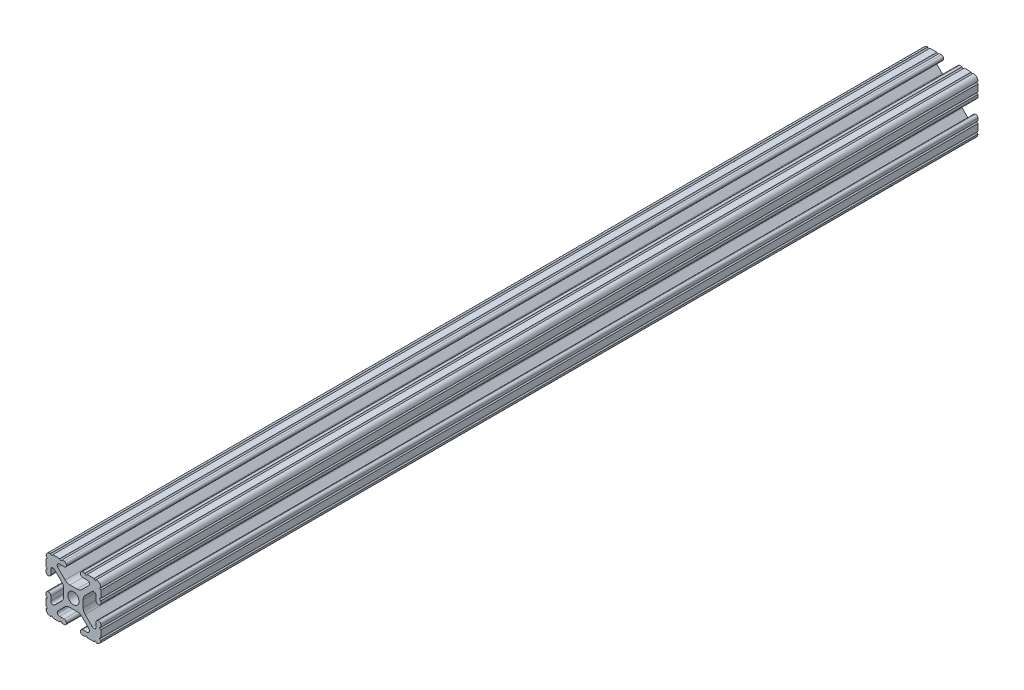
SolidWorks part; units mm, degrees
ref_plane "Front Plane" through (0, 0, 0) normal (0, 0, 1) x (1, 0, 0)
ref_plane "Top Plane" through (0, 0, 0) normal (0, 1, 0) x (1, 0, 0)
ref_plane "Right Plane" through (0, 0, 0) normal (1, 0, 0) x (0, 0, -1)
sketch "Sketch1" plane through (0, 0, 0) normal (0, 0, 1) x (1, 0, 0)
  line L88 (-7.1797, -8.6452) -> (-3.9523, -5.4237)
  line L89 (-1.7093, -4.4958) -> (1.7093, -4.4958)
  line L90 (3.9523, -5.4237) -> (7.1797, -8.6452)
  line L91 (6.4164, -10.4902) -> (4.2875, -10.4902)
  line L92 (3.2385, -11.5392) -> (3.2385, -11.651)
  line L93 (4.2875, -12.7) -> (5.3171, -12.7)
  line L94 (6.3331, -12.7) -> (9.5504, -12.7)
  line L95 (12.7, -9.5504) -> (12.7, -6.3331)
  line L96 (12.7, -5.3171) -> (12.7, -4.2875)
  line L97 (11.651, -3.2385) -> (11.5392, -3.2385)
  line L98 (10.4902, -4.2875) -> (10.4902, -6.4021)
  line L99 (8.7371, -7.1294) -> (5.441, -3.8408)
  line L100 (4.5085, -1.5932) -> (4.5085, 1.5932)
  line L101 (5.441, 3.8408) -> (8.7371, 7.1294)
  line L102 (10.4902, 6.4021) -> (10.4902, 4.2875)
  line L103 (11.5392, 3.2385) -> (11.651, 3.2385)
  line L104 (12.7, 4.2875) -> (12.7, 5.3171)
  line L105 (12.7, 6.3331) -> (12.7, 9.5504)
  line L106 (9.5504, 12.7) -> (6.3331, 12.7)
  line L107 (5.3171, 12.7) -> (4.2875, 12.7)
  line L108 (3.2385, 11.651) -> (3.2385, 11.5392)
  line L109 (4.2875, 10.4902) -> (6.4768, 10.4902)
  line L110 (7.207, 8.7244) -> (3.8983, 5.4232)
  line L111 (1.6558, 4.4958) -> (-1.6558, 4.4958)
  line L112 (-3.8983, 5.4232) -> (-7.207, 8.7244)
  line L113 (-6.4768, 10.4902) -> (-4.2875, 10.4902)
  line L114 (-3.2385, 11.5392) -> (-3.2385, 11.651)
  line L115 (-4.2875, 12.7) -> (-5.3171, 12.7)
  line L116 (-6.3331, 12.7) -> (-9.5504, 12.7)
  line L117 (-12.7, 9.5504) -> (-12.7, 6.3331)
  line L118 (-12.7, 5.3171) -> (-12.7, 4.2875)
  line L119 (-11.651, 3.2385) -> (-11.5392, 3.2385)
  line L120 (-10.4902, 4.2875) -> (-10.4902, 6.4021)
  line L121 (-8.7371, 7.1294) -> (-5.441, 3.8408)
  line L122 (-4.5085, 1.5932) -> (-4.5085, -1.5932)
  line L123 (-5.441, -3.8408) -> (-8.7371, -7.1294)
  line L124 (-10.4902, -6.4021) -> (-10.4902, -4.2875)
  line L125 (-11.5392, -3.2385) -> (-11.651, -3.2385)
  line L126 (-12.7, -4.2875) -> (-12.7, -5.3171)
  line L127 (-12.7, -6.3331) -> (-12.7, -9.5504)
  line L128 (-9.5504, -12.7) -> (-6.3331, -12.7)
  line L129 (-5.3171, -12.7) -> (-4.2875, -12.7)
  line L130 (-3.2385, -11.651) -> (-3.2385, -11.5392)
  line L131 (-4.2875, -10.4902) -> (-6.4164, -10.4902)
  circle A1 centre (0, 0) radius 2.6035
  arc A104 (-7.1797, -8.6452) -> (-6.4164, -10.4902) centre (-6.4164, -9.4098) ccw
  arc A105 (-1.7093, -4.4958) -> (-3.9523, -5.4237) centre (-1.7093, -7.6708) ccw
  arc A106 (3.9523, -5.4237) -> (1.7093, -4.4958) centre (1.7093, -7.6708) ccw
  arc A107 (6.4164, -10.4902) -> (7.1797, -8.6452) centre (6.4164, -9.4098) ccw
  arc A108 (4.2875, -10.4902) -> (3.2385, -11.5392) centre (4.2875, -11.5392) ccw
  arc A109 (3.2385, -11.651) -> (4.2875, -12.7) centre (4.2875, -11.651) ccw
  arc A110 (6.3331, -12.7) -> (5.3171, -12.7) centre (5.8251, -12.7) ccw
  arc A111 (10.5664, -12.6998) -> (9.5504, -12.7) centre (10.0584, -12.7) ccw
  arc A112 (10.5664, -12.6998) -> (12.6998, -10.5664) centre (10.5918, -10.5918) ccw
  arc A113 (12.7, -9.5504) -> (12.6998, -10.5664) centre (12.7, -10.0584) ccw
  arc A114 (12.7, -5.3171) -> (12.7, -6.3331) centre (12.7, -5.8251) ccw
  arc A115 (12.7, -4.2875) -> (11.651, -3.2385) centre (11.651, -4.2875) ccw
  arc A116 (11.5392, -3.2385) -> (10.4902, -4.2875) centre (11.5392, -4.2875) ccw
  arc A117 (8.7371, -7.1294) -> (10.4902, -6.4021) centre (9.4628, -6.4021) ccw
  arc A118 (4.5085, -1.5932) -> (5.441, -3.8408) centre (7.6835, -1.5932) ccw
  arc A119 (5.441, 3.8408) -> (4.5085, 1.5932) centre (7.6835, 1.5932) ccw
  arc A120 (10.4902, 6.4021) -> (8.7371, 7.1294) centre (9.4628, 6.4021) ccw
  arc A121 (10.4902, 4.2875) -> (11.5392, 3.2385) centre (11.5392, 4.2875) ccw
  arc A122 (11.651, 3.2385) -> (12.7, 4.2875) centre (11.651, 4.2875) ccw
  arc A123 (12.7, 6.3331) -> (12.7, 5.3171) centre (12.7, 5.8251) ccw
  arc A124 (12.6998, 10.5664) -> (12.7, 9.5504) centre (12.7, 10.0584) ccw
  arc A125 (12.6998, 10.5664) -> (10.5664, 12.6998) centre (10.5918, 10.5918) ccw
  arc A126 (9.5504, 12.7) -> (10.5664, 12.6998) centre (10.0584, 12.7) ccw
  arc A127 (5.3171, 12.7) -> (6.3331, 12.7) centre (5.8251, 12.7) ccw
  arc A128 (4.2875, 12.7) -> (3.2385, 11.651) centre (4.2875, 11.651) ccw
  arc A129 (3.2385, 11.5392) -> (4.2875, 10.4902) centre (4.2875, 11.5392) ccw
  arc A130 (7.207, 8.7244) -> (6.4768, 10.4902) centre (6.4768, 9.4563) ccw
  arc A131 (1.6558, 4.4958) -> (3.8983, 5.4232) centre (1.6558, 7.6708) ccw
  arc A132 (-3.8983, 5.4232) -> (-1.6558, 4.4958) centre (-1.6558, 7.6708) ccw
  arc A133 (-6.4768, 10.4902) -> (-7.207, 8.7244) centre (-6.4768, 9.4563) ccw
  arc A134 (-4.2875, 10.4902) -> (-3.2385, 11.5392) centre (-4.2875, 11.5392) ccw
  arc A135 (-3.2385, 11.651) -> (-4.2875, 12.7) centre (-4.2875, 11.651) ccw
  arc A136 (-6.3331, 12.7) -> (-5.3171, 12.7) centre (-5.8251, 12.7) ccw
  arc A137 (-10.5664, 12.6998) -> (-9.5504, 12.7) centre (-10.0584, 12.7) ccw
  arc A138 (-10.5664, 12.6998) -> (-12.6998, 10.5664) centre (-10.5918, 10.5918) ccw
  arc A139 (-12.7, 9.5504) -> (-12.6998, 10.5664) centre (-12.7, 10.0584) ccw
  arc A140 (-12.7, 5.3171) -> (-12.7, 6.3331) centre (-12.7, 5.8251) ccw
  arc A141 (-12.7, 4.2875) -> (-11.651, 3.2385) centre (-11.651, 4.2875) ccw
  arc A142 (-11.5392, 3.2385) -> (-10.4902, 4.2875) centre (-11.5392, 4.2875) ccw
  arc A143 (-8.7371, 7.1294) -> (-10.4902, 6.4021) centre (-9.4628, 6.4021) ccw
  arc A144 (-4.5085, 1.5932) -> (-5.441, 3.8408) centre (-7.6835, 1.5932) ccw
  arc A145 (-5.441, -3.8408) -> (-4.5085, -1.5932) centre (-7.6835, -1.5932) ccw
  arc A146 (-10.4902, -6.4021) -> (-8.7371, -7.1294) centre (-9.4628, -6.4021) ccw
  arc A147 (-10.4902, -4.2875) -> (-11.5392, -3.2385) centre (-11.5392, -4.2875) ccw
  arc A148 (-11.651, -3.2385) -> (-12.7, -4.2875) centre (-11.651, -4.2875) ccw
  arc A149 (-12.7, -6.3331) -> (-12.7, -5.3171) centre (-12.7, -5.8251) ccw
  arc A150 (-12.6998, -10.5664) -> (-12.7, -9.5504) centre (-12.7, -10.0584) ccw
  arc A151 (-12.6998, -10.5664) -> (-10.5664, -12.6998) centre (-10.5918, -10.5918) ccw
  arc A152 (-9.5504, -12.7) -> (-10.5664, -12.6998) centre (-10.0584, -12.7) ccw
  arc A153 (-5.3171, -12.7) -> (-6.3331, -12.7) centre (-5.8251, -12.7) ccw
  arc A154 (-4.2875, -12.7) -> (-3.2385, -11.651) centre (-4.2875, -11.651) ccw
  arc A155 (-3.2385, -11.5392) -> (-4.2875, -10.4902) centre (-4.2875, -11.5392) ccw
extrude "Boss-Extrude1" add sketch "Sketch1" along normal mid plane 406.4
sketch "Sketch2" plane through (0, 4.4958, 0) normal (0, 1, 0) x (1, 0, 0)
  line L0 (1.6558, 203.2) -> (-1.6558, 203.2) construction
  circle A0 centre (0, 33.909) radius 2.7686
  circle A1 centre (0, -33.909) radius 2.7686
extrude "Cut-Extrude1" [suppressed] cut sketch "Sketch2" against normal through all and the other way through all
equation "\"D4@Sketch2\"=\"D2@Sketch2\""
